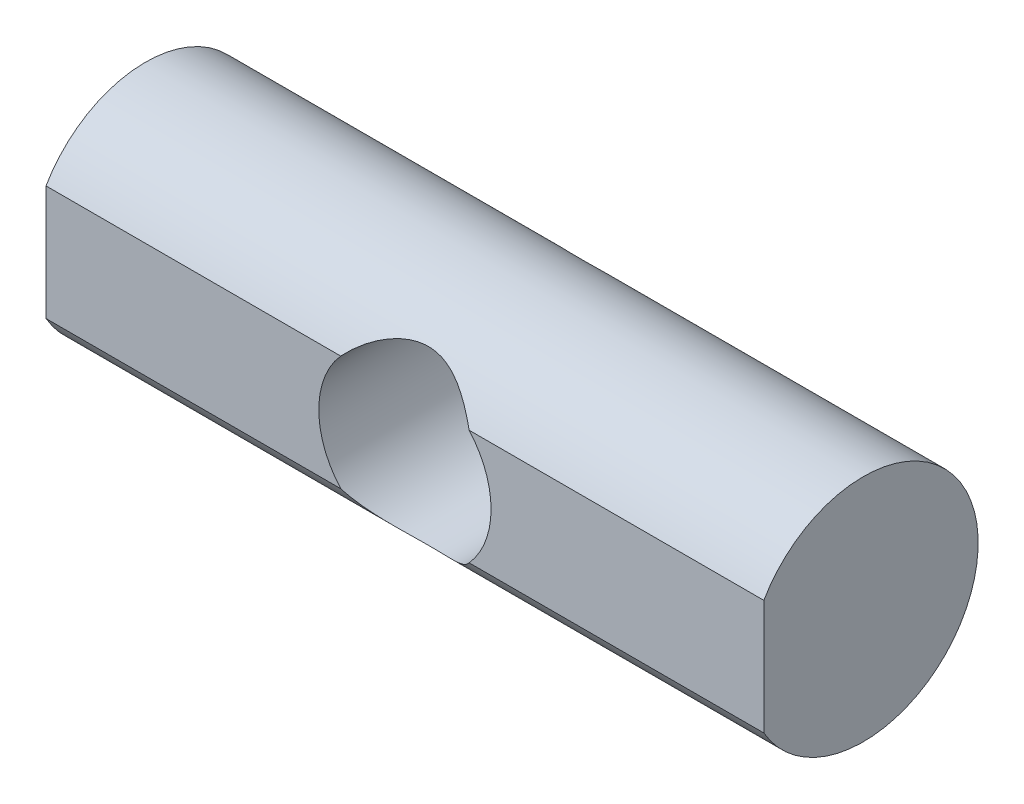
SolidWorks part; units mm, degrees
ref_plane "Front" through (0, 0, 0) normal (0, 0, 1) x (1, 0, 0)
ref_plane "Top" through (0, 0, 0) normal (0, 1, 0) x (1, 0, 0)
ref_plane "Right" through (0, 0, 0) normal (1, 0, 0) x (0, 0, -1)
sketch "Sketch1" plane through (0, 0, 0) normal (1, 0, 0) x (0, 0, -1)
  line L0 (-6.9282, 4) -> (-6.9282, -4)
  line L1 (0, 0) -> (8.7859, 0) construction
  circle A0 centre (0, 0) radius 8
  dimension "D1" = 16
  dimension "D2" = 8
extrude "Boss-Extrude1" add sketch "Sketch1" along normal mid plane 50
sketch "Sketch2" plane through (0, 0, 6.9282) normal (0, 0, 1) x (1, 0, 0)
  circle A0 centre (0, 0) radius 6
  dimension "D1" = 12
extrude "Cut-Extrude1" cut sketch "Sketch2" against normal through all
